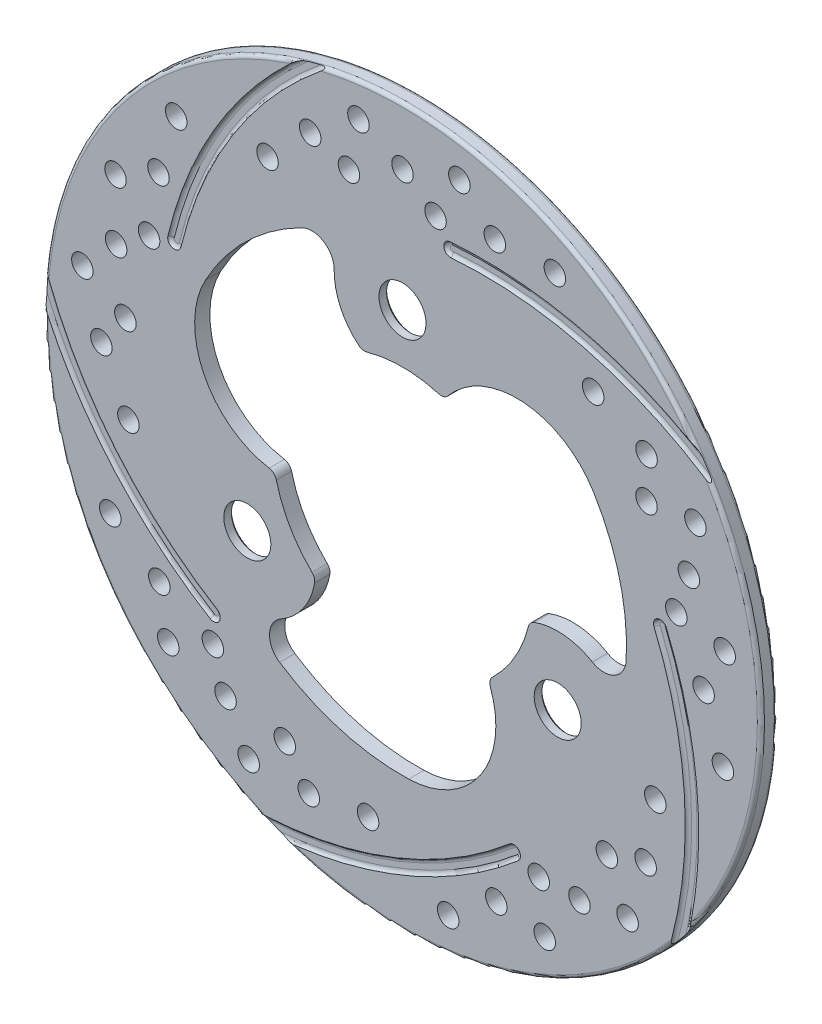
SolidWorks part; units mm, degrees
ref_plane "正面" through (0, 0, 0) normal (0, 0, 1) x (1, 0, 0)
ref_plane "平面" through (0, 0, 0) normal (0, 1, 0) x (1, 0, 0)
ref_plane "右側面" through (0, 0, 0) normal (1, 0, 0) x (0, 0, -1)
sketch "ｽｹｯﾁ1" plane through (0, 0, 0) normal (0, 0, 1) x (1, 0, 0)
  circle A0 centre (0, 0) radius 80
  dimension "D1" = 160
extrude "ﾎﾞｽ - 押し出し1" add sketch "ｽｹｯﾁ1" along normal blind 3.8
sketch "ｽｹｯﾁ2" plane through (0, 0, 0) normal (0, 0, -1) x (-1, 0, 0)
  circle A0 centre (0, 0) radius 29
  dimension "D1" = 58
extrude "ｶｯﾄ - 押し出し1" cut sketch "ｽｹｯﾁ2" against normal blind 4
sketch "ｽｹｯﾁ3" plane through (0, 0, 0) normal (0, 0, -1) x (-1, 0, 0)
  circle A0 centre (0, 0) radius 55
  dimension "D1" = 110
extrude "ｶｯﾄ - 押し出し2" cut sketch "ｽｹｯﾁ3" against normal blind 0.4
hole_wizard "M10 穴付きねじ用座ぐり穴1" positions "ｽｹｯﾁ8" profile "ｽｹｯﾁ9" counterbore size "M10" standard "JIS"
sketch "ｽｹｯﾁ8" plane through (0, 0, 0.4) normal (0, 0, -1) x (-1, 0, 0)
  line L0 (0, 0) -> (0, 40) construction
  line L1 (0, 0) -> (-34.641, -20) construction
  line L4 (0, 0) -> (34.641, -20) construction
  circle A0 centre (0, 0) radius 40
  point P0 (0, 40)
  point P14 (-34.641, -20)
  point P16 (34.641, -20)
  dimension "D1" = 80
  dimension "D2" = 120
  dimension "D3" = 120
sketch "ｽｹｯﾁ9" plane through (0, 40, 0.4) normal (1, 0, 0) x (0, 1, 0)
  line L0 (0, 0) -> (0, 3.4)
  line L1 (0, 3.4) -> (5.25, 3.4)
  line L3 (5.25, 3.4) -> (5.25, 1.2)
  line L4 (5.25, 1.2) -> (8.6, 1.2)
  line L5 (8.6, 1.2) -> (8.6, 0)
  line L7 (8.6, 0) -> (0, 0)
  line L11 (0, -6.35) -> (0, 107.95) construction
  dimension "通し穴の直径" = 10.5
  dimension "通し穴の深さ" = 3.4
  dimension "座ぐり穴の直径" = 17.2
  dimension "座ぐり穴の深さ" = 1.2
fillet "ﾌｨﾚｯﾄ2" radius 0.8 2 edges at (80, 0, 0) (80, 0, 3.8)
sketch "ｽｹｯﾁ7" plane through (0, 0, 0) normal (0, 0, -1) x (-1, 0, 0)
  line L0 (0, 0) -> (0, 67.2) construction
  line L1 (0, 67.2) -> (0, 80) construction
  line L2 (0, 69.6) -> (7.2855, 69.6) construction
  line L3 (0, 0) -> (-12.6978, 71.481) construction
  line L4 (-12.6978, 71.481) -> (-13.992, 78.7669) construction
  line L5 (-13.1175, 73.844) -> (-10.0182, 74.3945) construction
  line L6 (0, 0) -> (11.9528, 61.1426) construction
  line L7 (11.9528, 61.1426) -> (15.3486, 78.5138) construction
  line L8 (12.4132, 63.498) -> (16.6481, 62.6702) construction
  line L9 (-12.6978, 71.481) -> (0, 67.2) construction
  line L10 (0, 0) -> (20.6046, 63.9632) construction
  circle A1 centre (9.831, 71.9313) radius 2.4
  circle A2 centre (20.6046, 63.9632) radius 2.4
  circle A5 centre (30.1243, 54.5327) radius 2.4
  circle A9 centre (0, 67.2) radius 2.4
  circle A14 centre (0, 0) radius 80 construction
  circle A15 centre (-12.6978, 71.481) radius 2.4
  circle A16 centre (11.9528, 61.1426) radius 2.4
  circle A17 centre (-7.3703, 61.8625) radius 2.4
  circle A18 centre (-20.6046, 63.9632) radius 2.4
  circle A19 centre (-34.0034, 64.1446) radius 2.4
  point P18 (0, 0)
  point P19 (0, 0)
  point P27 (0, 0)
  point P33 (0, 0)
  point P34 (0, 0)
  dimension "D1" = 4.8
  dimension "D2" = 10.4
  dimension "D3" = 4.8
  dimension "D4" = 4.8
  dimension "D6" = 15.3
  dimension "D8" = 13.4
  dimension "D12" = 9.1
  dimension "D11" = 9.1
  dimension "D5" = 5
  dimension "D7" = 13.4
  dimension "D9" = 2
  dimension "D10" = 2
extrude "ｶｯﾄ - 押し出し6" cut sketch "ｽｹｯﾁ7" against normal through all
pattern_circular "円形ﾊﾟﾀｰﾝ1" count 5 over 360 about axis through (0, 0, 0) along (0, 0, 1) of "ｶｯﾄ - 押し出し6"
sketch "ｽｹｯﾁ10" plane through (0, 0, 0) normal (0, 0, -1) x (-1, 0, 0)
  line L0 (50.901, 27.8045) -> (0, 0) construction
  line L1 (49.5846, 27.0855) -> (49.3292, 27.5528) construction
  line L2 (48.2682, 26.3664) -> (45.5341, 30.8487) construction
  line L3 (56.5572, 26.1261) -> (50.901, 27.8045) construction
  line L4 (54.2564, 26.8089) -> (54.5334, 27.7425) construction
  line L5 (52.339, 27.3778) -> (53.0704, 29.8428) construction
  arc A0 (50.901, 27.8045) -> (19.7948, 77.7229) centre (-39.5316, 6.1033) ccw construction
  arc A1 (16.7845, 78.2194) -> (49.4424, 27.4545) centre (-39.5316, 6.1033) cw
  arc A2 (52.3596, 28.1546) -> (23.5689, 76.4494) centre (-39.5316, 6.1033) ccw
  arc A3 (49.4424, 27.4545) -> (52.3596, 28.1546) centre (50.901, 27.8045) ccw
  arc A4 (16.7845, 78.2194) -> (23.5689, 76.4494) centre (0, 0) cw
  circle A5 centre (0, 0) radius 80 construction
  arc A6 (11.5393, 61.3896) -> (-12.6978, 71.481) centre (-36.0514, -18.7603) ccw construction
  circle A7 centre (0, 0) radius 40 construction
  circle A8 centre (0, 0) radius 55 construction
  circle A9 centre (56.5572, 26.1261) radius 2.4 construction
  point P32 (50.0546, 34.79)
  point P33 (48.1649, 33.0243)
  point P34 (0, 0)
  dimension "D1" = 3
  dimension "D2" = 1.5
  dimension "D3" = 93
  dimension "D4" = 93.2141
  dimension "D5" = 1.5
  dimension "D6" = 2
extrude "ｶｯﾄ - 押し出し7" cut sketch "ｽｹｯﾁ10" against normal blind 0.55
fillet "ﾌｨﾚｯﾄ3" radius 1 3 edges at (-41.6637, 54.4517, 0.55) (-51.251, 26.3459, 0.55) (-37.445, 55.5689, 0.55)
pattern_circular "円形ﾊﾟﾀｰﾝ2" count 5 over 360 about axis through (0, 0, 0) along (0, 0, 1) of "ｶｯﾄ - 押し出し7", "ﾌｨﾚｯﾄ3"
chamfer "面取り1" distance 0.5 angle 45 3 edges at (29.391, -20, 1.6) (-39.891, -20, 1.6) (-5.25, 40, 1.6)
fillet "ﾌｨﾚｯﾄ1" radius 0.1 1 edges at (-55, 0, 0.4)
ref_plane "平面1" through (0, 0, 1.9) normal (0, 0, -1) x (-1, 0, 0)
mirror "ﾐﾗｰ1" about plane through (0, 0, 1.9) normal (0, 0, -1) of "ｶｯﾄ - 押し出し7", "ﾌｨﾚｯﾄ3", "円形ﾊﾟﾀｰﾝ2"
sketch "ｽｹｯﾁ11" plane through (0, 0, 0.4) normal (0, 0, -1) x (-1, 0, 0)
  line L0 (0, 40) -> (-25.5528, 15.718) construction
  line L1 (-11.0548, 29.495) -> (-15.0753, 33.726) construction
  line L2 (-3.8057, 36.3835) -> (-9.6514, 42.5351) construction
  arc A0 (-42.588, 26.1966) -> (-49.9192, -2.8412) centre (0, 0) ccw
  arc A1 (-49.9192, -2.8412) -> (-42.3875, -6.864) centre (-44.9273, -2.5571) ccw
  arc A2 (-42.3875, -6.864) -> (-28.3494, -6.1083) centre (-34.641, -20) cw
  arc A3 (-9.355, 27.4497) -> (-42.588, 26.1966) centre (-25.5528, 15.718) ccw
  circle A4 centre (0, 0) radius 80 construction
  circle A5 centre (0, 0) radius 29 construction
  arc A6 (-9.355, 27.4497) -> (-28.3494, -6.1083) centre (0, 0) ccw
  circle A7 centre (-34.641, -20) radius 5.25 construction
  circle A8 centre (0, 40) radius 5.25 construction
  point P20 (0, 0)
  point P24 (-13.8893, 36.6275)
  point P27 (-24.9023, 11.5786)
  point P28 (-40.7473, 29)
  dimension "D1" = 30
  dimension "D2" = 10
  dimension "D3" = 5
  dimension "D5" = 20
  dimension "D4" = 10
extrude "ｶｯﾄ - 押し出し8" cut sketch "ｽｹｯﾁ11" against normal through all
fillet "ﾌｨﾚｯﾄ4" radius 2 2 edges at (9.355, 27.4497, 2.1) (28.3494, -6.1083, 2.1)
pattern_circular "円形ﾊﾟﾀｰﾝ3" count 3 over 360 about axis through (0, 0, 0) along (0, 0, 1) of "ｶｯﾄ - 押し出し8", "ﾌｨﾚｯﾄ4"
